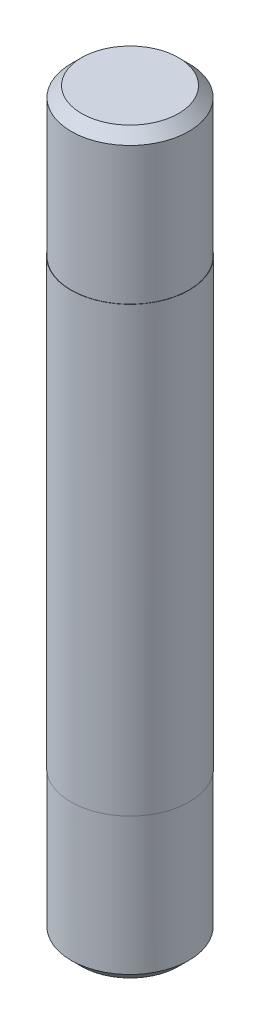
SolidWorks part; units mm, degrees
ref_plane "Front" through (0, 0, 0) normal (0, 0, 1) x (1, 0, 0)
ref_plane "Top" through (0, 0, 0) normal (0, 1, 0) x (1, 0, 0)
ref_plane "Right" through (0, 0, 0) normal (1, 0, 0) x (0, 0, -1)
sketch "Sketch1" plane through (0, 0, 0) normal (0, 1, 0) x (1, 0, 0)
  circle A0 centre (0, 0) radius 2
extrude "Extrude1" add sketch "Sketch1" along normal blind 25
sketch "Sketch2" plane through (0, 25, 0) normal (0, 1, 0) x (-1, 0, 0)
  circle A0 centre (0, 0) radius 2
  circle A1 centre (0, 0) radius 1.99
extrude "Cut-Extrude1" cut sketch "Sketch2" against normal blind 5
sketch "Sketch3" plane through (0, 0, 0) normal (0, -1, 0) x (1, 0, 0)
  circle A1 centre (0, 0) radius 2
  circle A2 centre (0, 0) radius 1.99
extrude "Cut-Extrude2" cut sketch "Sketch3" against normal blind 5
chamfer "Chamfer1" distance 0.35 angle 45 2 edges at (0, 0, -1.99) (0, 25, 1.99)
